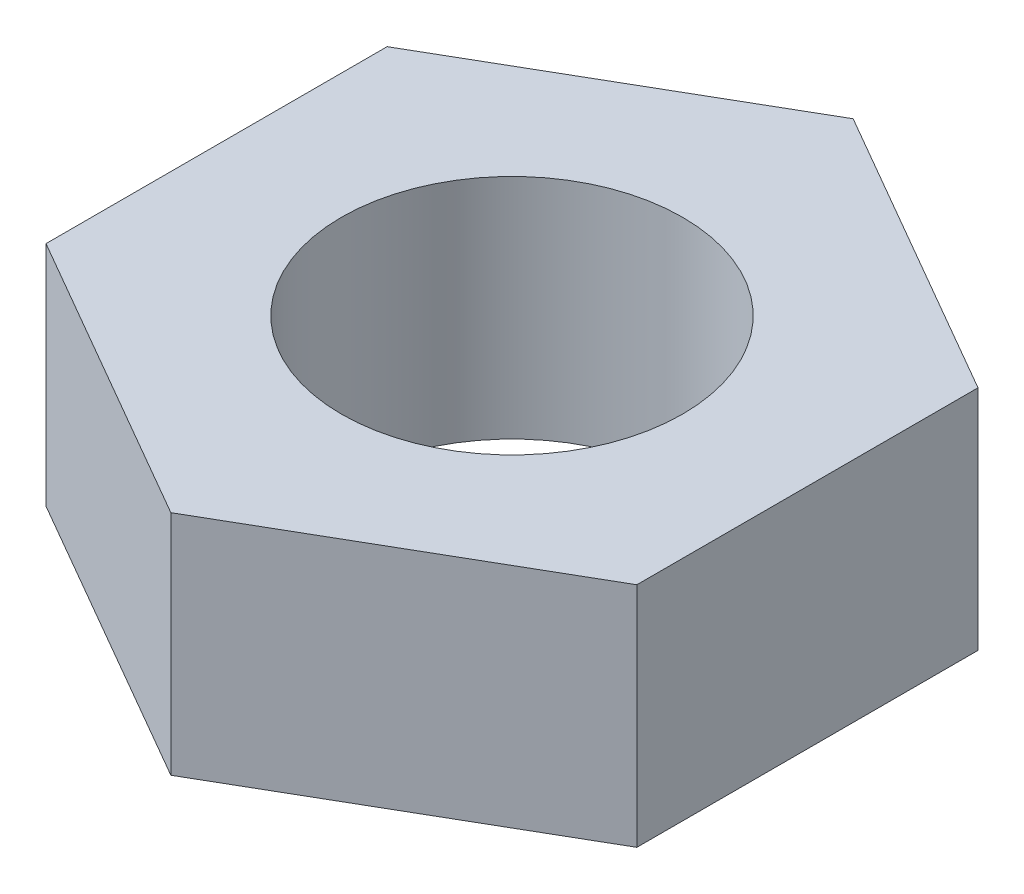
SolidWorks part; units mm, degrees
ref_plane "Front Plane" through (0, 0, 0) normal (0, 0, 1) x (1, 0, 0)
ref_plane "Top Plane" through (0, 0, 0) normal (0, 1, 0) x (1, 0, 0)
ref_plane "Right Plane" through (0, 0, 0) normal (1, 0, 0) x (0, 0, -1)
sketch "Sketch1" plane through (0, 0, 0) normal (0, 1, 0) x (1, 0, 0)
  line L1 (12.9904, 7.5) -> (0, 15)
  line L2 (0, 15) -> (-12.9904, 7.5)
  line L3 (-12.9904, 7.5) -> (-12.9904, -7.5)
  line L4 (-12.9904, -7.5) -> (0, -15)
  line L5 (0, -15) -> (12.9904, -7.5)
  line L6 (12.9904, -7.5) -> (12.9904, 7.5)
  circle A0 centre (0, 0) radius 12.9904 construction
  circle A1 centre (0, 0) radius 7.5
  dimension "D2" = 15
  dimension "D1" = 30
extrude "Extrude1" add sketch "Sketch1" along normal blind 10
